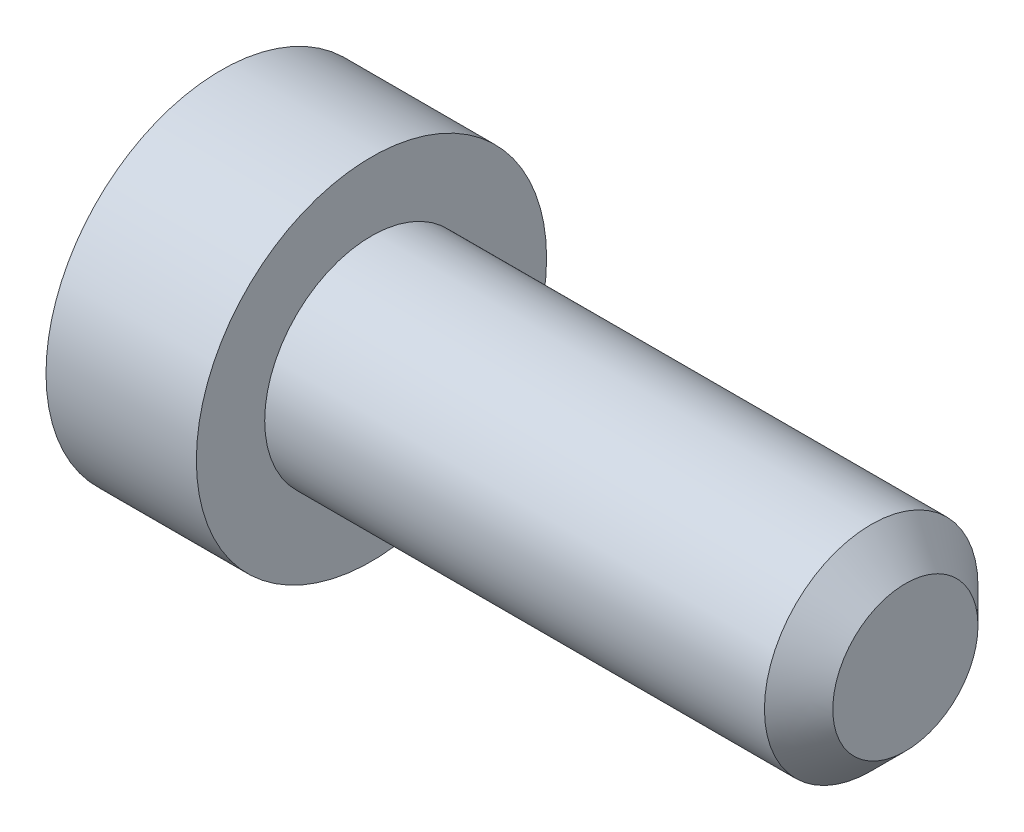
SolidWorks part; units mm, degrees
ref_plane "Plane1" through (0, 0, 0) normal (0, 0, 1) x (1, 0, 0)
ref_plane "Plane2" through (0, 0, 0) normal (0, 1, 0) x (1, 0, 0)
ref_plane "Plane3" through (0, 0, 0) normal (1, 0, 0) x (0, 0, -1)
revolve "Base-Revolve" add sketch "BodySke" angle 360 about L2
sketch "BodySke" plane through (0, 0, 0) normal (0, 0, 1) x (1, 0, 0)
  line L0 (3.048, 1.5875) -> (3.048, 2.6035)
  line L1 (3.048, 2.6035) -> (0.8128, 2.6035)
  line L2 (-25.4, 0) -> (127, 0) construction
  line L3 (10.9855, 0) -> (0, 0)
  line L4 (3.048, 1.5875) -> (10.9855, 1.5875)
  line L5 (10.9855, 1.5875) -> (10.9855, 0)
  line L6 (3.048, -2.6035) -> (0.8128, -2.6035) construction
  line L7 (3.048, -1.5875) -> (10.9855, -1.5875) construction
  line L8 (3.683, 1.2192) -> (3.683, -0.4698) construction
  line L9 (3.048, 1.2192) -> (3.048, -0.4698) construction
  arc A0 (0, 0) -> (0.8128, 2.6035) centre (4.5761, 0) cw
  dimension "Head_ht" = 3.048
  dimension "Diameter" = 3.175
  dimension "Length" = 7.9375
  dimension "Head_dia" = 5.207
  dimension "Head_side_ht" = 2.2352
  dimension "Advance" = 0.635
  dimension "Thread_nom" = 7.9375
sketch "Sketch2" plane through (0, 0, 0) normal (1, 0, 0) x (0, 0, -1)
  line L0 (-2.6035, -0.5461) -> (-2.6035, 0.5461)
  line L1 (-2.6035, 0.5461) -> (2.6035, 0.5461)
  line L2 (2.6035, 0.5461) -> (2.6035, -0.5461)
  line L3 (2.6035, -0.5461) -> (-2.6035, -0.5461)
  dimension "D1" = 5.207
  dimension "D2" = 2.6035
  dimension "D3" = 0.5461
  dimension "Slot_width" = 1.0922
extrude "Slot" [suppressed] cut sketch "Sketch2" along normal blind 1.3716
sketch "Sketch3" plane through (0, 0, 0) normal (1, 0, 0) x (0, 0, -1)
  line L0 (0.3937, -1.9558) -> (-0.3937, -1.9558)
  line L1 (0.3937, -1.9558) -> (0.3937, 1.9558)
  line L2 (-0.3937, 1.9558) -> (0.3937, 1.9558)
  line L3 (-0.3937, 1.9558) -> (-0.3937, -1.9558)
  dimension "D1" = 0.3937
  dimension "Cross_width" = 0.7874
  dimension "D2" = 1.9558
  dimension "Cross_dia" = 3.9116
ref_plane "Plane4" through (2.1844, 0, 0) normal (1, 0, 0) x (0, 0, -1)
sketch "Sketch4" plane through (2.1844, 0, 0) normal (1, 0, 0) x (0, 0, -1)
  line L0 (0.1969, -0.1969) -> (-0.1969, -0.1969)
  line L1 (0.1969, -0.1969) -> (0.1969, 0.1968)
  line L2 (-0.1969, 0.1968) -> (0.1969, 0.1968)
  line L3 (-0.1969, 0.1968) -> (-0.1969, -0.1969)
  dimension "D1" = 0.3937
  dimension "D2" = 0.1968
  dimension "D3" = 0.3937
  dimension "D4" = 0.1968
loft "Cross" cut profiles "Sketch3", "Sketch4"
pattern_circular "CirPattern1" count 2 every 90 about axis through (-25.4, 0, 0) along (1, 0, 0)
sketch "Sketch5" plane through (0, 0, 0) normal (0, 1, 0) x (1, 0, 0)
  line L4 (-25.4, 0) -> (127, 0) construction
  line L5 (3.048, -6.312) -> (3.048, 6.3337) construction
  circle A0 centre (2.0828, 0) radius 0.5842
  dimension "Drilled_hole_dia" = 1.1684
  dimension "D1" = 3.048
  dimension "Drilled_hole_loc" = 0.9652
extrude "Hole" [suppressed] cut sketch "Sketch5" against normal through all and the other way through all
sketch "ThdSchSke" plane through (0, 0, 0) normal (0, 0, 1) x (1, 0, 0)
  line L0 (3.683, -1.209) -> (3.418, -1.5875)
  line L1 (3.683, -1.209) -> (3.948, -1.5875)
  line L2 (3.948, -1.5875) -> (3.948, -1.9844)
  line L3 (-3.175, 0) -> (5.1513, 0) construction
  line L5 (3.948, -1.9844) -> (3.418, -1.9844)
  line L6 (3.418, -1.9844) -> (3.418, -1.5875)
  dimension "Thread_minor" = 2.4181
  dimension "Diameter" = 3.175
  dimension "Start" = 3.683
  dimension "SideAngle" = 55
  dimension "VeeAngle" = 70
  dimension "Overcut" = 3.9688
revolve "ThreadSchematic" [suppressed] cut sketch "ThdSchSke" angle 360 about L3
pattern_linear "ThdSchPat" [suppressed]
chamfer "Chamfer1" distance 0.508 angle 45
equation "\"D1@Sketch3\" = \"Cross_width@Sketch3\" / 2"
equation "\"D2@Sketch3\" = \"Cross_dia@Sketch3\" / 2"
equation "\"D1@Sketch4\" = \"Cross_width@Sketch3\"*.5"
equation "\"D2@Sketch4\" = \"D1@Sketch4\" / 2"
equation "\"D3@Sketch4\" = \"D1@Sketch4\""
equation "\"D4@Sketch4\" = \"D2@Sketch4\""
equation "\"D1@Sketch2\" = \"Head_dia@BodySke\""
equation "\"D2@Sketch2\" = \"D1@Sketch2\" / 2"
equation "\"D3@Sketch2\" = \"Slot_width@Sketch2\" / 2"
equation "\"D1@Sketch5\" = \"Head_ht@BodySke\""
equation "\"Thread_length@ThreadCosmetic\" = ((sgn( (\"Length@BodySke\" - \"Advance@BodySke\" ) - \"Thread_nom@BodySke\" )-1)*( (\"Length@BodySke\" - \"Advance@BodySke\" ) - \"Thread_nom@BodySke\" ))/-2+ \"Thread_nom@BodySke\""
equation "\"Thread_minor@ThdSchSke\" = \"Thread_minor@ThreadCosmetic\""
equation "\"Diameter@ThdSchSke\" = \"Diameter@BodySke\""
equation "\"Overcut@ThdSchSke\" = \"Diameter@BodySke\" * 1.25"
equation "\"Start@ThdSchSke\" = \"Head_ht@BodySke\" + \"Length@BodySke\" - \"Thread_length@ThreadCosmetic\"  '---Non-countersunk---"
equation "\"Num_threads@ThdSchPat\" = int( \"Thread_length@ThreadCosmetic\" / \"Advance@BodySke\" + 0.999 )  + 1"
equation "\"Advance@ThdSchPat\" = \"Thread_length@ThreadCosmetic\" /  (\"Num_threads@ThdSchPat\" - 1) 'relax it"
